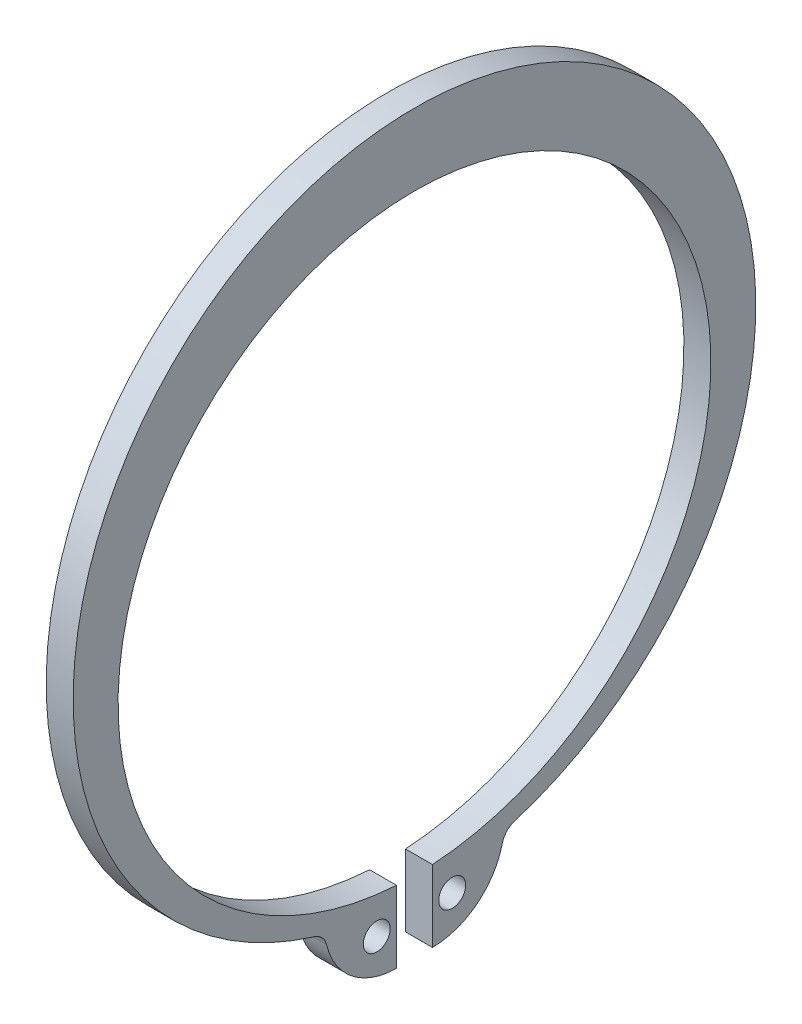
SolidWorks part; units mm, degrees
ref_plane "Plan1" through (0, 0, 0) normal (0, 0, 1) x (1, 0, 0)
ref_plane "Plan2" through (0, 0, 0) normal (0, 1, 0) x (1, 0, 0)
ref_plane "Plan3" through (0, 0, 0) normal (1, 0, 0) x (0, 0, -1)
sketch "Esquisse1" plane through (0, 0, 0) normal (1, 0, 0) x (0, 0, -1)
  line L3 (-1, -16.4697) -> (-1, -20.4697)
  line L5 (1, -16.4697) -> (1, -20.4697)
  arc A0 (1, -16.4697) -> (-1, -16.4697) centre (0, 0) ccw
  arc A1 (-5.5725, -16.6645) -> (-4.8926, -17.3903) centre (-5.8658, -17.6205) cw
  arc A2 (-4.8926, -17.3903) -> (-1, -20.4697) centre (-1, -16.4697) ccw
  arc A3 (5.5725, -16.6645) -> (4.8926, -17.3903) centre (5.8658, -17.6205) ccw
  circle A4 centre (-2.1, -18.3847) radius 0.75
  arc A5 (1, -20.4697) -> (4.8926, -17.3903) centre (1, -16.4697) ccw
  arc A6 (5.5725, -16.6645) -> (-5.5725, -16.6645) centre (0, 1.5) ccw
  circle A7 centre (2.1, -18.3847) radius 0.75
  dimension "D2" = 33
  dimension "D3" = 1
  dimension "D6" = 8
  dimension "D7" = 2.1
  dimension "D4" = 1.5
  dimension "D5" = 1.5
  dimension "D1" = 1.5
  dimension "D8" = 2.1
extrude "Base-Extrusion" add sketch "Esquisse1" along normal blind 1.5
